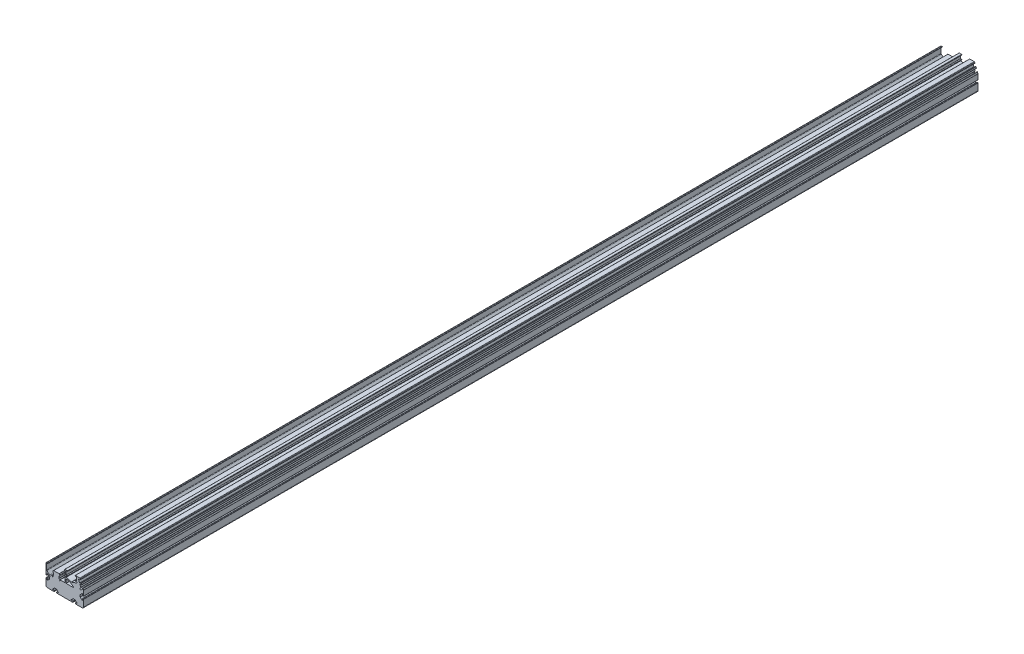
SolidWorks part; units mm, degrees
ref_plane "前视基准面" through (0, 0, 0) normal (0, 0, 1) x (1, 0, 0)
ref_plane "上视基准面" through (0, 0, 0) normal (0, 1, 0) x (1, 0, 0)
ref_plane "右视基准面" through (0, 0, 0) normal (1, 0, 0) x (0, 0, -1)
sketch "草图1" plane through (0, 0, 0) normal (0, 0, 1) x (1, 0, 0)
  point P0 (0, 0)
  line B0 (-40, 43) -> (-40, 23)
  line B1 (-37, 0) -> (-22.9, 0)
  line B2 (-16.9, 0) -> (16.9, 0)
  line B3 (-40, 17) -> (-40, 3)
  line B4 (-37, 30.2255) -> (-37, 35.1341)
  line B5 (-23.6097, 24) -> (-31.6872, 14.3736)
  arc B6 (-8.137, 5.7086) -> (-5.2735, 6.1676) centre (-6.7052, 5.9381) cw
  arc B7 (-2.8676, 8.5735) -> (-5.2735, 6.1676) centre (-3.2, 6.5) cw
  line B8 (1.5, 2.8) -> (1.5, 24)
  line B9 (-1.5, 11.8675) -> (-1.5, 24)
  arc B10 (-18.9401, 28.8601) -> (18.9401, 28.8601) centre (0, 9.1989) cw
  line B11 (-0.5, 46) -> (-9, 46)
  arc B12 (-32.013, 6.2667) -> (-29.0223, 6.1) centre (-30.5223, 6.1) cw
  line B13 (-17.7929, 7.3) -> (-13.8464, 3.3536)
  line B14 (-16.6938, 9.4536) -> (-9.6866, 2.4464)
  line B15 (-25.9536, 3.3536) -> (-22.0071, 7.3)
  line B16 (-28.1687, 4.3911) -> (-23.1062, 9.4536)
  arc B17 (-25.6, 2.5) -> (-25.9536, 3.3536) centre (-25.6, 3) cw
  arc B18 (-37, 0) -> (-40, 3) centre (-37, 3) cw
  arc B19 (34.1756, 8.5986) -> (33.2541, 9.3097) centre (34.2116, 9.598) cw
  arc B20 (34.1756, 8.5986) -> (32.013, 6.2667) centre (34.1, 6.5) cw
  line B21 (40, 3) -> (40, 17)
  line B22 (22.9, 0) -> (37, 0)
  line B23 (39.9642, 34.0894) -> (38.923, 36.6926)
  line B24 (-26.5, 39.3517) -> (-26.5, 25.7157)
  line B25 (-31.7829, 14.1964) -> (-33.2541, 9.3097)
  arc B26 (-40, 43) -> (-37, 46) centre (-37, 43) cw
  line B27 (-37.5, 23) -> (-37.5, 25.7)
  arc B28 (-32.013, 6.2667) -> (-34.1756, 8.5986) centre (-34.1, 6.5) cw
  line B29 (28.1687, 4.3911) -> (23.1062, 9.4536)
  line B30 (24.9, 51.3) -> (24.9, 45.8)
  line B31 (26.5, 40.2) -> (14.2747, 35.9905)
  line B32 (24.1757, 36.5441) -> (18.0045, 34.4192)
  line B33 (23.6097, 24) -> (31.6872, 14.3736)
  line B34 (31.7829, 14.1964) -> (33.2541, 9.3097)
  arc B35 (29.0223, 6.1) -> (32.013, 6.2667) centre (30.5223, 6.1) cw
  line B36 (13.8464, 3.3536) -> (17.7929, 7.3)
  line B37 (-1.5, 24) -> (-23.6097, 24)
  arc B38 (-34.8646, 37.3029) -> (-34.9665, 35.3055) centre (-34.9156, 36.3042) cw
  line B39 (-26.617, 25.3943) -> (-28.7993, 22.7935)
  line B40 (9.3331, 2.3) -> (2, 2.3)
  line B41 (1.5, 24) -> (23.6097, 24)
  line B42 (17.7929, 7.3) -> (22.0071, 7.3)
  line B43 (22.7527, 9.6) -> (17.0473, 9.6)
  line B44 (2.9, 45.8) -> (2.9, 51.3)
  line B45 (18.5932, 28) -> (-18.5932, 28)
  line B46 (23.1345, 28.6111) -> (28.8251, 21.8294)
  arc B47 (17.8714, 33.5434) -> (23.1345, 28.6111) centre (0, 9.1989) cw
  line B48 (-29.5359, 22.7614) -> (-37, 30.2255)
  arc B49 (-34.8646, 37.3029) -> (-32.5029, 39.6646) centre (-34.75, 39.55) cw
  line B50 (-32.7, 17.8929) -> (-36.6464, 13.9464)
  line B51 (32.7, 17.8929) -> (32.7, 22.1071)
  line B52 (-22.7527, 9.6) -> (-17.0473, 9.6)
  arc B53 (-2.8676, 8.5735) -> (-2.4086, 11.437) centre (-2.6381, 10.0052) cw
  line B54 (-36.6464, 26.0536) -> (-32.7, 22.1071)
  arc B55 (-13.0456, 37.6811) -> (-22.9544, 37.6811) centre (-18, 49.7) cw
  line B56 (-9.5, 43.8) -> (-14.9, 43.8)
  line B57 (0, 51.5) -> (0, 46.5)
  arc B58 (1.7707, 39.347) -> (13.8821, 36.0192) centre (0, 9.1989) cw
  arc B59 (22, 52) -> (22.5, 52.5) centre (22.5, 52) cw
  line B60 (29.0625, 48.9578) -> (32.3122, 50.2576)
  line B61 (31.5137, 42.8298) -> (29.0625, 48.9578)
  arc B62 (26.7003, 36.7154) -> (29.2134, 34.5155) centre (28.95, 36.75) cw
  line B63 (-15.2662, 41.6561) -> (-12.7646, 38.9655)
  line B64 (2.9, 51.3) -> (5.3, 51.3)
  line B65 (-27, 46) -> (-37, 46)
  line B66 (-23.2354, 38.9655) -> (-20.7338, 41.6561)
  arc B67 (-30.5055, 39.7665) -> (-32.5029, 39.6646) centre (-31.5042, 39.7156) cw
  line B68 (-26.5, 43.8) -> (-26.5, 45.5)
  line B69 (26.5, 44.5) -> (26.5, 40.2)
  line B70 (1.3, 44.5) -> (5.3, 44.5)
  line B71 (-30.0723, 41.7029) -> (-26.75, 39.7847)
  line B72 (-14.2, 2.5) -> (-16.9, 2.5)
  line B73 (37.5, 17) -> (37.5, 14.3)
  line B74 (29.5617, 21.7972) -> (36.8536, 29.0891)
  arc B75 (34.9969, 32.0491) -> (32.5928, 34.4532) centre (33.7949, 33.2512) cw
  arc B76 (29.4475, 32.5292) -> (29.2134, 34.5155) centre (29.3304, 33.5223) cw
  arc B77 (26.7003, 36.7154) -> (24.7924, 36.2809) centre (25.7004, 36.7) cw
  arc B78 (36.178, 30.4208) -> (30.2441, 32.2109) centre (33.7949, 33.2512) cw
  line B79 (-21.1, 43.8) -> (-26.5, 43.8)
  line B80 (-15.4, 43.3) -> (-15.4, 41.9965)
  line B81 (-20.6, 42.0016) -> (-20.6, 43.3)
  arc B82 (-22.9544, 37.6811) -> (-23.2354, 38.9655) centre (-22.6495, 38.4207) cw
  arc B83 (-30.7884, 41.0888) -> (-30.5055, 39.7665) centre (-34.75, 39.55) cw
  arc B84 (-20.6, 41.9965) -> (-20.7338, 41.6561) centre (-21.1, 41.9965) cw
  arc B85 (-27, 46) -> (-26.5, 45.5) centre (-27, 45.5) cw
  arc B86 (-21.1, 43.8) -> (-20.6, 43.3) centre (-21.1, 43.3) cw
  arc B87 (-26.75, 39.7847) -> (-26.5, 39.3517) centre (-27, 39.3517) cw
  arc B88 (-30.7884, 41.0888) -> (-30.0723, 41.7029) centre (-30.3223, 41.2698) cw
  arc B89 (-12.7646, 38.9655) -> (-13.0456, 37.6811) centre (-13.3505, 38.4207) cw
  arc B90 (-15.2662, 41.6561) -> (-15.4, 41.9965) centre (-14.9, 41.9965) cw
  line B91 (-9.5, 45.5) -> (-9.5, 43.8)
  arc B92 (-15.4, 43.3) -> (-14.9, 43.8) centre (-14.9, 43.3) cw
  arc B93 (-9.5, 45.5) -> (-9, 46) centre (-9, 45.5) cw
  line B94 (32.1822, 41.1586) -> (35.4319, 42.4584)
  line B95 (32.7, 22.1071) -> (36.6464, 26.0536)
  arc B96 (40, 3) -> (37, 0) centre (37, 3) cw
  line B97 (22.0071, 7.3) -> (25.9536, 3.3536)
  arc B98 (29.6786, 32.5629) -> (30.2441, 32.2109) centre (29.7643, 32.0703) cw
  arc B99 (5.8, 51.8) -> (5.3, 51.3) centre (5.3, 51.8) cw
  line B100 (32.5928, 34.4532) -> (33.9822, 35.8427)
  line B101 (-17.4, 2) -> (-17.4, 0.5)
  line B102 (22.5, 44.5) -> (26.5, 44.5)
  arc B103 (17.8714, 33.5434) -> (18.0045, 34.4192) centre (18.1673, 33.9464) cw
  arc B104 (31.9232, 52.5) -> (32.8514, 51.8719) centre (31.9232, 51.5) cw
  line B105 (31.9232, 52.5) -> (22.5, 52.5)
  arc B106 (5.3, 52.5) -> (5.8, 52) centre (5.3, 52) cw
  line B107 (5.3, 52.5) -> (1, 52.5)
  line B108 (5.8, 51.8) -> (5.8, 52)
  line B109 (1.3, 39.8461) -> (1.3, 44.5)
  arc B110 (0, 51.5) -> (1, 52.5) centre (1, 51.5) cw
  line B111 (5.3, 45.8) -> (2.9, 45.8)
  arc B112 (5.3, 45.8) -> (5.8, 45.3) centre (5.3, 45.3) cw
  arc B113 (5.8, 45) -> (5.3, 44.5) centre (5.3, 45) cw
  arc B114 (1.7707, 39.347) -> (1.3, 39.8461) centre (1.8, 39.8461) cw
  arc B115 (14.2747, 35.9905) -> (13.8821, 36.0192) centre (14.1119, 36.4633) cw
  arc B116 (22.5, 44.5) -> (22, 45) centre (22.5, 45) cw
  arc B117 (22, 45.3) -> (22.5, 45.8) centre (22.5, 45.3) cw
  line B118 (24.9, 45.8) -> (22.5, 45.8)
  arc B119 (22.5, 51.3) -> (22, 51.8) centre (22.5, 51.8) cw
  line B120 (22, 45.3) -> (22, 45)
  line B121 (5.8, 45) -> (5.8, 45.3)
  line B122 (22, 52) -> (22, 51.8)
  arc B123 (33.3901, 50.5272) -> (33.1115, 49.8773) centre (32.9259, 50.3415) cw
  line B124 (33.3901, 50.5272) -> (32.8514, 51.8719)
  arc B125 (33.0187, 49.8402) -> (32.3688, 50.1187) centre (32.833, 50.3044) cw
  arc B126 (35.0791, 44.956) -> (35.729, 44.6775) centre (35.2648, 44.4918) cw
  arc B127 (34.7077, 44.269) -> (34.9862, 44.9189) centre (35.1719, 44.4546) cw
  arc B128 (36.1375, 42.0406) -> (35.4876, 42.3192) centre (35.9518, 42.5048) cw
  arc B129 (36.5089, 42.7277) -> (36.2304, 42.0777) centre (36.0447, 42.542) cw
  line B130 (34.0929, 36.3819) -> (32.1822, 41.1586)
  arc B131 (34.0929, 36.3819) -> (33.9822, 35.8427) centre (33.6286, 36.1962) cw
  line B132 (37.9016, 36.2841) -> (38.2817, 35.3339)
  arc B133 (37.9016, 36.2841) -> (38.1802, 36.934) centre (38.3659, 36.4697) cw
  line B134 (38.273, 36.9711) -> (38.1802, 36.934)
  arc B135 (38.273, 36.9711) -> (38.923, 36.6926) centre (38.4587, 36.5069) cw
  line B136 (40, 23) -> (40, 33.9037)
  line B137 (38.2817, 35.3339) -> (34.9969, 32.0491)
  arc B138 (39.9642, 34.0894) -> (40, 33.9037) centre (39.5, 33.9037) cw
  line B139 (35.4319, 42.4584) -> (35.4876, 42.3192)
  line B140 (36.1375, 42.0406) -> (36.2304, 42.0777)
  line B141 (36.5089, 42.7277) -> (35.729, 44.6775)
  line B142 (35.0791, 44.956) -> (34.9862, 44.9189)
  line B143 (34.7077, 44.269) -> (34.7634, 44.1297)
  line B144 (32.3122, 50.2576) -> (32.3688, 50.1187)
  line B145 (33.0187, 49.8402) -> (33.1115, 49.8773)
  arc B146 (24.1757, 36.5441) -> (24.7924, 36.2809) centre (24.3385, 36.0713) cw
  line B147 (34.7634, 44.1297) -> (31.5137, 42.8298)
  line B148 (22.5, 51.3) -> (24.9, 51.3)
  line B149 (16.6938, 9.4536) -> (9.6866, 2.4464)
  line B150 (36.6464, 13.9464) -> (32.7, 17.8929)
  line B151 (39.5, 17.5) -> (38, 17.5)
  line B152 (-32.7, 22.1071) -> (-32.7, 17.8929)
  line B153 (-39.5, 22.5) -> (-38, 22.5)
  arc B154 (-39.5, 22.5) -> (-40, 23) centre (-39.5, 23) cw
  arc B155 (-37.5, 23) -> (-38, 22.5) centre (-38, 23) cw
  arc B156 (-37.5, 25.7) -> (-36.6464, 26.0536) centre (-37, 25.7) cw
  line B157 (-37.5, 14.3) -> (-37.5, 17)
  arc B158 (-36.6464, 13.9464) -> (-37.5, 14.3) centre (-37, 14.3) cw
  line B159 (-38, 17.5) -> (-39.5, 17.5)
  arc B160 (-38, 17.5) -> (-37.5, 17) centre (-38, 17) cw
  arc B161 (-40, 17) -> (-39.5, 17.5) centre (-39.5, 17) cw
  arc B162 (18.9401, 28.8601) -> (18.5932, 28) centre (18.5932, 28.5) cw
  arc B163 (40, 23) -> (39.5, 22.5) centre (39.5, 23) cw
  line B164 (37.5, 25.7) -> (37.5, 23)
  arc B165 (38, 22.5) -> (37.5, 23) centre (38, 23) cw
  arc B166 (36.6464, 26.0536) -> (37.5, 25.7) centre (37, 25.7) cw
  arc B167 (37.5, 14.3) -> (36.6464, 13.9464) centre (37, 14.3) cw
  arc B168 (37.5, 17) -> (38, 17.5) centre (38, 17) cw
  arc B169 (39.5, 17.5) -> (40, 17) centre (39.5, 17) cw
  arc B170 (29.5617, 21.7972) -> (28.8251, 21.8294) centre (29.2081, 22.1508) cw
  arc B171 (-22.4, 0.5) -> (-22.9, 0) centre (-22.9, 0.5) cw
  arc B172 (-22.9, 2.5) -> (-22.4, 2) centre (-22.9, 2) cw
  line B173 (-22.0071, 7.3) -> (-17.7929, 7.3)
  arc B174 (-13.8464, 3.3536) -> (-14.2, 2.5) centre (-14.2, 3) cw
  arc B175 (-17.4, 2) -> (-16.9, 2.5) centre (-16.9, 2) cw
  arc B176 (-16.9, 0) -> (-17.4, 0.5) centre (-16.9, 0.5) cw
  line B177 (-22.4, 0.5) -> (-22.4, 2)
  arc B178 (-28.1687, 4.3911) -> (-29.0223, 4.7446) centre (-28.5223, 4.7446) cw
  arc B179 (-33.2541, 9.3097) -> (-34.1756, 8.5986) centre (-34.2116, 9.598) cw
  arc B180 (-31.7829, 14.1964) -> (-31.6872, 14.3736) centre (-31.3041, 14.0522) cw
  arc B181 (-1.5, 11.8675) -> (-2.1091, 11.3795) centre (-2, 11.8675) cw
  arc B182 (-2.4086, 11.437) -> (-2.1091, 11.3795) centre (-3.2, 6.5) cw
  arc B183 (-6.8995, 3.1364) -> (-7.2694, 2.3) centre (-7.2694, 2.8) cw
  arc B184 (-6.8995, 3.1364) -> (-8.137, 5.7086) centre (-3.2, 6.5) cw
  line B185 (-9.3331, 2.3) -> (-7.2694, 2.3)
  arc B186 (-9.3331, 2.3) -> (-9.6866, 2.4464) centre (-9.3331, 2.8) cw
  arc B187 (-23.1062, 9.4536) -> (-22.7527, 9.6) centre (-22.7527, 9.1) cw
  arc B188 (-17.0473, 9.6) -> (-16.6938, 9.4536) centre (-17.0473, 9.1) cw
  line B189 (-22.9, 2.5) -> (-25.6, 2.5)
  line B190 (-29.0223, 6.1) -> (-29.0223, 4.7446)
  arc B191 (-18.5932, 28) -> (-18.9401, 28.8601) centre (-18.5932, 28.5) cw
  line B192 (22.4, 2) -> (22.4, 0.5)
  arc B193 (17.4, 0.5) -> (16.9, 0) centre (16.9, 0.5) cw
  arc B194 (22.9, 0) -> (22.4, 0.5) centre (22.9, 0.5) cw
  arc B195 (22.4, 2) -> (22.9, 2.5) centre (22.9, 2) cw
  arc B196 (25.9536, 3.3536) -> (25.6, 2.5) centre (25.6, 3) cw
  line B197 (16.9, 2.5) -> (14.2, 2.5)
  arc B198 (16.9, 2.5) -> (17.4, 2) centre (16.9, 2) cw
  line B199 (17.4, 0.5) -> (17.4, 2)
  arc B200 (14.2, 2.5) -> (13.8464, 3.3536) centre (14.2, 3) cw
  arc B201 (2, 2.3) -> (1.5, 2.8) centre (2, 2.8) cw
  arc B202 (31.6872, 14.3736) -> (31.7829, 14.1964) centre (31.3041, 14.0522) cw
  arc B203 (29.0223, 4.7446) -> (28.1687, 4.3911) centre (28.5223, 4.7446) cw
  line B204 (29.0223, 6.1) -> (29.0223, 4.7446)
  arc B205 (22.7527, 9.6) -> (23.1062, 9.4536) centre (22.7527, 9.1) cw
  arc B206 (16.6938, 9.4536) -> (17.0473, 9.6) centre (17.0473, 9.1) cw
  arc B207 (9.6866, 2.4464) -> (9.3331, 2.3) centre (9.3331, 2.8) cw
  arc B208 (-28.7993, 22.7935) -> (-29.5359, 22.7614) centre (-29.1823, 23.1149) cw
  arc B209 (-26.5, 25.7157) -> (-26.617, 25.3943) centre (-27, 25.7157) cw
  arc B210 (-37, 35.1341) -> (-36.3158, 35.5989) centre (-36.5, 35.1341) cw
  arc B211 (-34.9665, 35.3055) -> (-36.3158, 35.5989) centre (-34.75, 39.55) cw
  arc B212 (29.6786, 32.5629) -> (29.4475, 32.5292) centre (28.95, 36.75) cw
  arc B213 (36.178, 30.4208) -> (37, 30.0383) centre (36.5, 30.0383) cw
  arc B214 (37, 29.4426) -> (36.8536, 29.0891) centre (36.5, 29.4426) cw
  line B215 (37, 29.4426) -> (37, 30.0383)
sketch_block_instance "XYZ-DG182-3"
sketch_block "XYZ-DG182"
sketch "草图2" plane through (0, 0, 0) normal (0, 0, 1) x (1, 0, 0)
  line L0 (-37, 0) -> (37, 0)
  line L3 (40, 3) -> (40, 52.5)
  line L4 (40, 52.5) -> (1, 52.5)
  line L5 (-40, 43) -> (-40, 3)
  line L7 (-37, 46) -> (-27, 46)
  line L8 (0, 46.5) -> (0, 51.5)
  line L9 (-20.7338, 41.6561) -> (-23.2354, 38.9655)
  line L10 (-26.5, 45.5) -> (-26.5, 43.8)
  line L11 (-26.5, 43.8) -> (-21.1, 43.8)
  line L12 (-20.6, 43.3) -> (-20.6, 41.9965)
  line L13 (-12.7646, 38.9655) -> (-15.2662, 41.6561)
  line L14 (-15.4, 41.9965) -> (-15.4, 43.3)
  line L15 (-14.9, 43.8) -> (-9.5, 43.8)
  line L16 (-9.5, 43.8) -> (-9.5, 45.5)
  line L17 (-9, 46) -> (-0.5, 46)
  arc A0 (-20.7338, 41.6561) -> (-20.6, 41.9965) centre (-21.1, 41.9965) ccw
  arc A1 (-23.2354, 38.9655) -> (-22.9544, 37.6811) centre (-22.6495, 38.4207) ccw
  arc A2 (-22.9544, 37.6811) -> (-13.0456, 37.6811) centre (-18, 49.7) ccw
  arc A3 (-12.7646, 38.9655) -> (-13.0456, 37.6811) centre (-13.3505, 38.4207) cw
  arc A4 (-15.2662, 41.6561) -> (-15.4, 41.9965) centre (-14.9, 41.9965) cw
  arc A5 (-14.9, 43.8) -> (-15.4, 43.3) centre (-14.9, 43.3) ccw
  arc A6 (-9.5, 45.5) -> (-9, 46) centre (-9, 45.5) cw
  arc A7 (-21.1, 43.8) -> (-20.6, 43.3) centre (-21.1, 43.3) cw
  arc A8 (-37, 46) -> (-40, 43) centre (-37, 43) ccw
  arc A9 (-40, 3) -> (-37, 0) centre (-37, 3) ccw
  arc A10 (37, 0) -> (40, 3) centre (37, 3) ccw
  arc A11 (-27, 46) -> (-26.5, 45.5) centre (-27, 45.5) cw
  arc A12 (1, 52.5) -> (0, 51.5) centre (1, 51.5) ccw
  arc A13 (0, 46.5) -> (-0.5, 46) centre (-0.5, 46.5) cw
  dimension "D2" = 3
  dimension "D8" = 0.5
  dimension "D9" = 1
  dimension "D7" = 0.5
  dimension "D5" = 3
  dimension "D6" = 3
  dimension "D4" = 0.5
  dimension "D10" = 0.5
  dimension "D1" = 52.5
  dimension "D3" = 40
extrude "凸台-拉伸1" add sketch "草图2" along normal blind 1905
sketch "草图3" plane through (0, 0, 1905) normal (0, 0, 1) x (1, 0, 0)
  line L0 (5.8, 52) -> (5.8, 51.8)
  line L1 (5.3, 51.3) -> (2.9, 51.3)
  line L2 (2.9, 51.3) -> (2.9, 45.8)
  line L3 (2.9, 45.8) -> (5.3, 45.8)
  line L4 (5.3, 44.5) -> (1.3, 44.5)
  line L5 (1.3, 44.5) -> (1.3, 39.8461)
  line L6 (14.2747, 35.9905) -> (26.5, 40.2)
  line L7 (26.5, 40.2) -> (26.5, 44.5)
  line L8 (26.5, 44.5) -> (22.5, 44.5)
  line L9 (22, 45) -> (22, 45.3)
  line L10 (5.8, 45) -> (5.8, 45.3)
  line L11 (22, 52) -> (22, 51.8)
  line L12 (22.5, 51.3) -> (24.9, 51.3)
  line L13 (24.9, 51.3) -> (24.9, 45.8)
  line L14 (24.9, 45.8) -> (22.5, 45.8)
  arc A0 (5.3, 52.5) -> (5.8, 52) centre (5.3, 52) cw
  arc A1 (5.3, 51.3) -> (5.8, 51.8) centre (5.3, 51.8) ccw
  arc A2 (5.3, 45.8) -> (5.8, 45.3) centre (5.3, 45.3) cw
  arc A3 (5.8, 45) -> (5.3, 44.5) centre (5.3, 45) cw
  arc A4 (1.3, 39.8461) -> (1.7707, 39.347) centre (1.8, 39.8461) ccw
  arc A5 (13.8821, 36.0192) -> (14.2747, 35.9905) centre (14.1119, 36.4633) ccw
  arc A6 (1.7707, 39.347) -> (13.8821, 36.0192) centre (0, 9.1989) cw
  arc A7 (22.5, 44.5) -> (22, 45) centre (22.5, 45) cw
  arc A8 (22.5, 45.8) -> (22, 45.3) centre (22.5, 45.3) ccw
  arc A9 (22.5, 52.5) -> (22, 52) centre (22.5, 52) ccw
  arc A10 (22, 51.8) -> (22.5, 51.3) centre (22.5, 51.8) ccw
  dimension "D1" = 0.5
  dimension "D2" = 0.5
  dimension "D3" = 0.5
  dimension "D4" = 30.2
  dimension "D5" = 0.5
  dimension "D6" = 0.5
extrude "切除-拉伸2" cut sketch "草图3" against normal through all and the other way through all flip side to cut
sketch "草图4" plane through (0, 0, 1905) normal (0, 0, 1) x (1, 0, 0)
  line L0 (39.9642, 34.0894) -> (38.923, 36.6926)
  line L1 (38.273, 36.9711) -> (38.1802, 36.934)
  line L2 (37.9016, 36.2841) -> (38.2817, 35.3339)
  line L3 (38.2817, 35.3339) -> (34.9969, 32.0491)
  line L4 (32.5928, 34.4532) -> (33.9822, 35.8427)
  line L6 (34.0929, 36.3819) -> (32.1822, 41.1586)
  line L8 (35.4876, 42.3192) -> (35.4319, 42.4584)
  line L9 (35.4319, 42.4584) -> (32.1822, 41.1586)
  line L10 (36.1375, 42.0406) -> (36.2304, 42.0777)
  line L11 (36.5089, 42.7277) -> (35.729, 44.6775)
  line L12 (35.0791, 44.956) -> (34.9862, 44.9189)
  line L13 (34.7077, 44.269) -> (34.7634, 44.1297)
  line L14 (34.7634, 44.1297) -> (31.5137, 42.8298)
  line L15 (31.5137, 42.8298) -> (29.0625, 48.9578)
  line L16 (29.0625, 48.9578) -> (32.3122, 50.2576)
  line L17 (32.3122, 50.2576) -> (32.3688, 50.1187)
  line L18 (33.0187, 49.8402) -> (33.1115, 49.8773)
  line L19 (32.8514, 51.8719) -> (33.3901, 50.5272)
  arc A0 (31.9232, 52.5) -> (32.8514, 51.8719) centre (31.9232, 51.5) cw
  arc A1 (33.3901, 50.5272) -> (33.1115, 49.8773) centre (32.9259, 50.3415) cw
  arc A2 (33.0187, 49.8402) -> (32.3688, 50.1187) centre (32.833, 50.3044) cw
  arc A3 (34.7077, 44.269) -> (34.9862, 44.9189) centre (35.1719, 44.4546) cw
  arc A4 (35.0791, 44.956) -> (35.729, 44.6775) centre (35.2648, 44.4918) cw
  arc A5 (36.5089, 42.7277) -> (36.2304, 42.0777) centre (36.0447, 42.542) cw
  arc A6 (36.1375, 42.0406) -> (35.4876, 42.3192) centre (35.9518, 42.5048) cw
  arc A7 (34.0929, 36.3819) -> (33.9822, 35.8427) centre (33.6286, 36.1962) cw
  arc A8 (32.5928, 34.4532) -> (34.9969, 32.0491) centre (33.7949, 33.2512) ccw
  arc A9 (37.9016, 36.2841) -> (38.1802, 36.934) centre (38.3659, 36.4697) cw
  arc A10 (38.273, 36.9711) -> (38.923, 36.6926) centre (38.4587, 36.5069) cw
  arc A11 (39.9642, 34.0894) -> (40, 33.9037) centre (39.5, 33.9037) cw
  dimension "D1" = 1
  dimension "D2" = 0.5
  dimension "D3" = 0.5
  dimension "D4" = 1.7
  dimension "D5" = 0.5
  dimension "D6" = 0.5
  dimension "D7" = 0.5
extrude "切除-拉伸7" cut sketch "草图4" against normal through all
sketch "草图5" plane through (0, 0, 1905) normal (0, 0, 1) x (1, 0, 0)
  line L0 (-38, 17.5) -> (-39.5, 17.5)
  line L1 (-37.5, 14.3) -> (-37.5, 17)
  line L2 (-36.6464, 13.9464) -> (-32.7, 17.8929)
  line L3 (-32.7, 17.8929) -> (-32.7, 22.1071)
  line L4 (-32.7, 22.1071) -> (-36.6464, 26.0536)
  line L5 (-37.5, 25.7) -> (-37.5, 23)
  line L6 (-39.5, 22.5) -> (-38, 22.5)
  arc A0 (-40, 23) -> (-39.5, 22.5) centre (-39.5, 23) ccw
  arc A1 (-38, 22.5) -> (-37.5, 23) centre (-38, 23) ccw
  arc A2 (-37.5, 25.7) -> (-36.6464, 26.0536) centre (-37, 25.7) cw
  arc A3 (-36.6464, 13.9464) -> (-37.5, 14.3) centre (-37, 14.3) cw
  arc A4 (-38, 17.5) -> (-37.5, 17) centre (-38, 17) cw
  arc A5 (-40, 17) -> (-39.5, 17.5) centre (-39.5, 17) cw
  dimension "D1" = 0.5
  dimension "D2" = 0.5
  dimension "D3" = 0.5
  dimension "D4" = 0.5
  dimension "D5" = 0.5
extrude "切除-拉伸8" cut sketch "草图5" against normal through all
sketch "草图6" plane through (0, 0, 1905) normal (0, 0, 1) x (1, 0, 0)
  line L0 (38, 17.5) -> (39.5, 17.5)
  line L1 (37.5, 17) -> (37.5, 14.3)
  line L2 (36.6464, 13.9464) -> (32.7, 17.8929)
  line L3 (32.7, 17.8929) -> (32.7, 22.1071)
  line L4 (32.7, 22.1071) -> (36.6464, 26.0536)
  line L5 (37.5, 25.7) -> (37.5, 23)
  line L6 (38, 22.5) -> (39.5, 22.5)
  arc A0 (39.5, 22.5) -> (40, 23) centre (39.5, 23) ccw
  arc A1 (38, 22.5) -> (37.5, 23) centre (38, 23) cw
  arc A2 (37.5, 25.7) -> (36.6464, 26.0536) centre (37, 25.7) ccw
  arc A3 (36.6464, 13.9464) -> (37.5, 14.3) centre (37, 14.3) ccw
  arc A4 (37.5, 17) -> (38, 17.5) centre (38, 17) cw
  arc A5 (39.5, 17.5) -> (40, 17) centre (39.5, 17) cw
  dimension "D3" = 0.5
  dimension "D4" = 0.5
extrude "切除-拉伸9" cut sketch "草图6" against normal through all
sketch "草图8" plane through (0, 0, 1905) normal (0, 0, 1) x (1, 0, 0)
  line L0 (17.4, 0.5) -> (17.4, 2)
  line L1 (16.9, 2.5) -> (14.2, 2.5)
  line L2 (13.8464, 3.3536) -> (17.7929, 7.3)
  line L3 (17.7929, 7.3) -> (22.0071, 7.3)
  line L4 (22.0071, 7.3) -> (25.9536, 3.3536)
  line L5 (25.6, 2.5) -> (22.9, 2.5)
  line L6 (22.4, 2) -> (22.4, 0.5)
  arc A0 (16.9, 0) -> (17.4, 0.5) centre (16.9, 0.5) ccw
  arc A1 (22.4, 0.5) -> (22.9, 0) centre (22.9, 0.5) ccw
  arc A2 (22.4, 2) -> (22.9, 2.5) centre (22.9, 2) cw
  arc A3 (25.6, 2.5) -> (25.9536, 3.3536) centre (25.6, 3) ccw
  arc A4 (17.4, 2) -> (16.9, 2.5) centre (16.9, 2) ccw
  arc A5 (14.2, 2.5) -> (13.8464, 3.3536) centre (14.2, 3) cw
  dimension "D1" = 0.5
  dimension "D2" = 0.5
  dimension "D3" = 0.5
  dimension "D4" = 0.5
extrude "切除-拉伸14" cut sketch "草图8" against normal through all flip side to cut
sketch "草图9" plane through (0, 0, 1905) normal (0, 0, 1) x (1, 0, 0)
  line L0 (22.7527, 9.6) -> (17.0473, 9.6)
  line L1 (16.6938, 9.4536) -> (9.6866, 2.4464)
  line L2 (2, 2.3) -> (9.3331, 2.3)
  line L3 (1.5, 2.8) -> (1.5, 24)
  line L4 (1.5, 24) -> (23.6097, 24)
  line L5 (23.6097, 24) -> (31.6872, 14.3736)
  line L6 (31.7829, 14.1964) -> (33.2541, 9.3097)
  line L7 (29.0223, 6.1) -> (29.0223, 4.7446)
  line L8 (23.1062, 9.4536) -> (28.1687, 4.3911)
  arc A0 (2, 2.3) -> (1.5, 2.8) centre (2, 2.8) cw
  arc A1 (31.6872, 14.3736) -> (31.7829, 14.1964) centre (31.3041, 14.0522) cw
  arc A2 (33.2541, 9.3097) -> (34.1756, 8.5986) centre (34.2116, 9.598) ccw
  arc A3 (28.1687, 4.3911) -> (29.0223, 4.7446) centre (28.5223, 4.7446) ccw
  arc A4 (29.0223, 6.1) -> (32.013, 6.2667) centre (30.5223, 6.1) cw
  arc A5 (34.1756, 8.5986) -> (32.013, 6.2667) centre (34.1, 6.5) cw
  arc A6 (22.7527, 9.6) -> (23.1062, 9.4536) centre (22.7527, 9.1) cw
  arc A7 (16.6938, 9.4536) -> (17.0473, 9.6) centre (17.0473, 9.1) cw
  arc A8 (9.3331, 2.3) -> (9.6866, 2.4464) centre (9.3331, 2.8) ccw
  dimension "D1" = 0.5
  dimension "D2" = 0.5
extrude "切除-拉伸15" [suppressed] cut sketch "草图9" against normal through all
sketch "草图11" plane through (0, 0, 1905) normal (0, 0, 1) x (1, 0, 0)
  line L0 (-28.7993, 22.7935) -> (-26.617, 25.3943)
  line L1 (-26.5, 25.7157) -> (-26.5, 39.3517)
  line L2 (-26.75, 39.7847) -> (-30.0723, 41.7029)
  line L3 (-37, 35.1341) -> (-37, 30.2255)
  line L4 (-37, 30.2255) -> (-29.5359, 22.7614)
  arc A0 (-29.5359, 22.7614) -> (-28.7993, 22.7935) centre (-29.1823, 23.1149) ccw
  arc A1 (-26.617, 25.3943) -> (-26.5, 25.7157) centre (-27, 25.7157) ccw
  arc A2 (-37, 35.1341) -> (-36.3158, 35.5989) centre (-36.5, 35.1341) cw
  arc A3 (-36.3158, 35.5989) -> (-34.9665, 35.3055) centre (-34.75, 39.55) ccw
  arc A4 (-34.9665, 35.3055) -> (-34.8646, 37.3029) centre (-34.9156, 36.3042) ccw
  arc A5 (-32.5029, 39.6646) -> (-34.8646, 37.3029) centre (-34.75, 39.55) ccw
  arc A6 (-30.5055, 39.7665) -> (-32.5029, 39.6646) centre (-31.5042, 39.7156) cw
  arc A7 (-30.7884, 41.0888) -> (-30.5055, 39.7665) centre (-34.75, 39.55) cw
  arc A8 (-30.0723, 41.7029) -> (-30.7884, 41.0888) centre (-30.3223, 41.2698) ccw
  arc A9 (-26.75, 39.7847) -> (-26.5, 39.3517) centre (-27, 39.3517) cw
  dimension "D1" = 0.5
  dimension "D2" = 0.5
  dimension "D3" = 0.5
extrude "切除-拉伸16" cut sketch "草图11" against normal through all
sketch "草图12" plane through (0, 0, 1905) normal (0, 0, 1) x (1, 0, 0)
  line L0 (-18.5932, 28) -> (18.5932, 28)
  arc A0 (-18.9401, 28.8601) -> (-18.5932, 28) centre (-18.5932, 28.5) ccw
  arc A1 (18.5932, 28) -> (18.9401, 28.8601) centre (18.5932, 28.5) ccw
  arc A2 (-18.9401, 28.8601) -> (18.9401, 28.8601) centre (0, 9.1989) cw
extrude "切除-拉伸17" cut sketch "草图12" against normal through all
sketch "草图13" plane through (0, 0, 1905) normal (0, 0, 1) x (1, 0, 0)
  line L0 (23.1345, 28.6111) -> (28.8251, 21.8294)
  line L1 (29.5617, 21.7972) -> (36.8536, 29.0891)
  line L2 (37, 30.0383) -> (37, 29.4426)
  line L3 (29.4483, 32.5223) -> (29.6786, 32.5629)
  line L4 (24.1757, 36.5441) -> (18.0045, 34.4192)
  arc A0 (17.8714, 33.5434) -> (18.0045, 34.4192) centre (18.1673, 33.9464) cw
  arc A1 (24.1757, 36.5441) -> (24.7924, 36.2809) centre (24.3385, 36.0713) cw
  arc A2 (26.7003, 36.7154) -> (24.7924, 36.2809) centre (25.7004, 36.7) cw
  arc A3 (29.2134, 34.5155) -> (26.7003, 36.7154) centre (28.95, 36.75) ccw
  arc A4 (29.2134, 34.5155) -> (29.4483, 32.5223) centre (29.3308, 33.5189) ccw
  arc A5 (29.6786, 32.5629) -> (30.2441, 32.2109) centre (29.7643, 32.0703) cw
  arc A6 (36.178, 30.4208) -> (30.2441, 32.2109) centre (33.7949, 33.2512) cw
  arc A7 (37, 30.0383) -> (36.178, 30.4208) centre (36.5, 30.0383) ccw
  arc A8 (36.8536, 29.0891) -> (37, 29.4426) centre (36.5, 29.4426) ccw
  arc A9 (29.5617, 21.7972) -> (28.8251, 21.8294) centre (29.2081, 22.1508) cw
  arc A10 (23.1345, 28.6111) -> (17.8714, 33.5434) centre (0, 9.1989) ccw
  dimension "D1" = 1.0035
  dimension "D2" = 0.5
  dimension "D4" = 0.5
  dimension "D3" = 0.2338
extrude "切除-拉伸18" [suppressed] cut sketch "草图13" against normal through all
sketch "草图14" plane through (0, 0, 1905) normal (0, 0, 1) x (1, 0, 0)
  line L0 (-29.0223, 4.7446) -> (-29.0223, 6.1)
  line L1 (-28.1687, 4.3911) -> (-23.1062, 9.4536)
  line L2 (-33.2541, 9.3097) -> (-31.7829, 14.1964)
  line L3 (-31.6872, 14.3736) -> (-23.6097, 24)
  line L4 (-23.6097, 24) -> (-1.5, 24)
  line L5 (-1.5, 24) -> (-1.5, 11.8675)
  line L6 (-2.4086, 11.437) -> (-2.1091, 11.3795)
  line L7 (-9.3331, 2.3) -> (-7.2694, 2.3)
  line L8 (-9.6866, 2.4464) -> (-16.6938, 9.4536)
  line L9 (-17.0473, 9.6) -> (-22.7527, 9.6)
  arc A0 (-34.1756, 8.5986) -> (-32.013, 6.2667) centre (-34.1, 6.5) ccw
  arc A1 (-33.2541, 9.3097) -> (-34.1756, 8.5986) centre (-34.2116, 9.598) cw
  arc A2 (-31.7829, 14.1964) -> (-31.6872, 14.3736) centre (-31.3041, 14.0522) cw
  arc A3 (-1.5, 11.8675) -> (-2.1091, 11.3795) centre (-2, 11.8675) cw
  arc A4 (-2.4086, 11.437) -> (-2.8676, 8.5735) centre (-2.6381, 10.0052) ccw
  arc A5 (-5.2735, 6.1676) -> (-2.8676, 8.5735) centre (-3.2, 6.5) ccw
  arc A6 (-8.137, 5.7086) -> (-5.2735, 6.1676) centre (-6.7052, 5.9381) cw
  arc A7 (-6.8995, 3.1364) -> (-7.2694, 2.3) centre (-7.2694, 2.8) cw
  arc A8 (-8.137, 5.7086) -> (-6.8995, 3.1364) centre (-3.2, 6.5) ccw
  arc A9 (-9.3331, 2.3) -> (-9.6866, 2.4464) centre (-9.3331, 2.8) cw
  arc A10 (-17.0473, 9.6) -> (-16.6938, 9.4536) centre (-17.0473, 9.1) cw
  arc A11 (-22.7527, 9.6) -> (-23.1062, 9.4536) centre (-22.7527, 9.1) ccw
  arc A12 (-29.0223, 4.7446) -> (-28.1687, 4.3911) centre (-28.5223, 4.7446) ccw
  arc A13 (-29.0223, 6.1) -> (-32.013, 6.2667) centre (-30.5223, 6.1) ccw
  dimension "D1" = 1
  dimension "D2" = 0.5
  dimension "D3" = 1.45
  dimension "D4" = 0.5
  dimension "D5" = 0.5
  dimension "D6" = 0.5
extrude "切除-拉伸20" [suppressed] cut sketch "草图14" against normal through all
sketch "草图15" plane through (0, 0, 1905) normal (0, 0, 1) x (1, 0, 0)
  line L0 (-17.4, 2) -> (-17.4, 0.5)
  line L1 (-22.4, 0.5) -> (-22.4, 2)
  line L2 (-16.9, 2.5) -> (-14.2, 2.5)
  line L3 (-13.8464, 3.3536) -> (-17.7929, 7.3)
  line L4 (-17.7929, 7.3) -> (-22.0071, 7.3)
  line L5 (-22.0071, 7.3) -> (-25.9536, 3.3536)
  line L6 (-25.6, 2.5) -> (-22.9, 2.5)
  arc A0 (-22.9, 0) -> (-22.4, 0.5) centre (-22.9, 0.5) ccw
  arc A1 (-22.4, 2) -> (-22.9, 2.5) centre (-22.9, 2) ccw
  arc A2 (-25.6, 2.5) -> (-25.9536, 3.3536) centre (-25.6, 3) cw
  arc A3 (-13.8464, 3.3536) -> (-14.2, 2.5) centre (-14.2, 3) cw
  arc A4 (-16.9, 2.5) -> (-17.4, 2) centre (-16.9, 2) ccw
  arc A5 (-17.4, 0.5) -> (-16.9, 0) centre (-16.9, 0.5) ccw
  dimension "D1" = 0.5
  dimension "D2" = 0.5
extrude "切除-拉伸21" cut sketch "草图15" against normal through all and the other way through all flip side to cut
sketch "草图16" plane through (0, 0, 0) normal (0, 0, -1) x (-1, 0, 0)
  line L1 (0, 54.1382) -> (37, 54.1382)
  line L2 (0, 54.1382) -> (0, 30.2255)
  line L3 (0, 30.2255) -> (37, 30.2255)
  line L4 (37, 54.1382) -> (37, 30.2255)
  line L5 (0, 51.5) -> (0, 46.5) construction
extrude "切除-拉伸22" cut sketch "草图16" against normal through all
sketch "草图17" plane through (0, 0, 0) normal (0, 0, -1) x (-1, 0, 0)
  line L0 (18.5932, 28) -> (-18.5932, 28) construction
  line L1 (17.4119, 28) -> (26.5, 28)
  line L2 (17.4119, 28) -> (17.4119, 30.2255)
  line L3 (17.4119, 30.2255) -> (26.5, 30.2255)
  line L4 (26.5, 28) -> (26.5, 30.2255)
extrude "切除-拉伸23" cut sketch "草图17" against normal through all
sketch "草图18" plane through (0, 0, 0) normal (0, 0, -1) x (-1, 0, 0)
  line L0 (26.5, 28) -> (-18.5932, 28) construction
  line L1 (0, 51.5) -> (-2.9, 51.5)
  line L2 (0, 51.5) -> (0, 28)
  line L3 (0, 28) -> (-2.9, 28)
  line L4 (-2.9, 51.5) -> (-2.9, 28)
  line L5 (-2.9, 45.8) -> (-2.9, 51.3) construction
extrude "凸台-拉伸2" add sketch "草图18" against normal up to surface (1905 mm away)
sketch "草图21" plane through (0, 0, 0) normal (0, 0, -1) x (-1, 0, 0)
  line L0 (26.5, 28) -> (0, 28) construction
  line L1 (10, 28) -> (26, 28)
  line L2 (10, 28) -> (10, 25.8)
  line L3 (10, 25.8) -> (26, 25.8)
  line L4 (26, 28) -> (26, 25.8)
  line L5 (40, 43) -> (40, 23) construction
  dimension "D1" = 16
  dimension "D2" = 14
  dimension "D3" = 2.2
extrude "切除-拉伸24" cut sketch "草图21" against normal through all
sketch "草图22" plane through (0, 0, 0) normal (0, 0, -1) x (-1, 0, 0)
  line L0 (26.5, 28) -> (27.6941, 28)
  line L4 (37, 30.2255) -> (29.5359, 22.7614) construction
  line L5 (28.7993, 22.7935) -> (26.617, 25.3943) construction
  line L6 (26.5, 25.7157) -> (26.5, 28) construction
  line L7 (30.9246, 24.1501) -> (29.5359, 22.7614)
  line L8 (28.7993, 22.7935) -> (26.617, 25.3943)
  line L9 (26.5, 25.7157) -> (26.5, 28)
  line L10 (27.6941, 28) -> (30.9246, 24.1501)
  arc A1 (28.7993, 22.7935) -> (29.5359, 22.7614) centre (29.1823, 23.1149) ccw construction
  arc A2 (26.5, 25.7157) -> (26.617, 25.3943) centre (27, 25.7157) ccw construction
  arc A3 (28.7993, 22.7935) -> (29.5359, 22.7614) centre (29.1823, 23.1149) ccw
  arc A4 (26.5, 25.7157) -> (26.617, 25.3943) centre (27, 25.7157) ccw
  dimension "D1" = 2.5
extrude "凸台-拉伸3" add sketch "草图22" against normal up to surface (1905 mm away)
sketch "草图27" plane through (0, 0, 0) normal (0, 0, -1) x (-1, 0, 0)
  line L0 (37, 46) -> (37, 30.2255)
  line L1 (37, 30.2255) -> (38.5, 31.7255)
  line L2 (38.5, 31.7255) -> (38.5, 46)
  line L3 (38.5, 46) -> (37, 46)
  line L4 (37, 30.2255) -> (30.9246, 24.1501) construction
  dimension "D1" = 1.5
extrude "切除-拉伸27" cut sketch "草图27" against normal through all
sketch "草图28" plane through (0, 0, 0) normal (0, 0, -1) x (-1, 0, 0)
  line L0 (40, 43) -> (40, 23) construction
  line L1 (40, 43) -> (38.5, 43)
  line L2 (40, 43) -> (40, 46)
  line L3 (40, 46) -> (38.5, 46)
  line L4 (38.5, 43) -> (38.5, 46)
  line L5 (38.5, 31.7255) -> (38.5, 45.5981) construction
  line L6 (37, 0) -> (22.9, 0) construction
  arc A0 (40, 43) -> (38.5, 45.5981) centre (37, 43) ccw construction
  dimension "D1" = 46
extrude "凸台-拉伸7" add sketch "草图28" against normal up to surface (1905 mm away)
sketch "草图29" plane through (0, 0, 0) normal (0, 0, -1) x (-1, 0, 0)
  line L1 (38.5, 46) -> (36, 46)
  line L2 (38.5, 46) -> (38.5, 44.8)
  line L3 (38.5, 44.8) -> (36, 44.8)
  line L4 (36, 46) -> (36, 44.8)
  dimension "D1" = 2.5
  dimension "D2" = 1.2
extrude "凸台-拉伸8" add sketch "草图29" against normal up to surface (1905 mm away)
fillet "圆角1" radius 2 2 edges at (-30.9246, 24.1501, 952.5) (-38.5, 31.7255, 952.5)
fillet "圆角3" radius 0.5 3 edges at (-36, 46, 952.5) (-36, 44.8, 952.5) (-38.5, 44.8, 952.5)
fillet "圆角4" radius 2 1 edges at (-40, 46, 952.5)
sketch "草图31" plane through (0, 0, 0) normal (0, 0, -1) x (-1, 0, 0)
  line L1 (-26.5, 44.5) -> (-26.5, 40.2) construction
  line L2 (-26.5, 42) -> (-22, 42)
  line L3 (-26.5, 42) -> (-26.5, 45.8)
  line L4 (-26.5, 45.8) -> (-22, 45.8)
  line L5 (-2.9, 42) -> (-2.9, 45.8)
  line L7 (-22.5, 44.5) -> (-26.5, 44.5) construction
  line L8 (-22, 45.8) -> (-22, 42)
  line L9 (-5.8, 45.8) -> (-5.8, 42)
  line L10 (-5.8, 45) -> (-5.8, 45.3) construction
  line L11 (-22, 45.3) -> (-22, 45) construction
  line L12 (-5.8, 45.8) -> (-2.9, 45.8)
  line L13 (-5.8, 42) -> (-2.9, 42)
  dimension "D1" = 2.5
extrude "凸台-拉伸9" add sketch "草图31" against normal up to surface (1905 mm away)
sketch "草图32" plane through (0, 0, 0) normal (0, 0, -1) x (-1, 0, 0)
  line L0 (-24.9, 51.3) -> (-24.9, 45.8) construction
  line L1 (-24.9, 43.3) -> (-2.9, 43.3)
  line L2 (-24.9, 43.3) -> (-24.9, 45.8)
  line L3 (-24.9, 45.8) -> (-2.9, 45.8)
  line L4 (-2.9, 43.3) -> (-2.9, 45.8)
  line L5 (-26.5, 42) -> (-22, 42) construction
  dimension "D1" = 1.3
extrude "切除-拉伸28" cut sketch "草图32" against normal through all
fillet "圆角5" radius 0.5 4 edges at (22, 42, 952.5) (5.8, 42, 952.5) (5.8, 43.3, 952.5) (22, 43.3, 952.5)
sketch "草图37" plane through (0, 0, 0) normal (0, 0, -1) x (-1, 0, 0)
  line L0 (0, 51.5) -> (0, 28) construction
  line L2 (-1, 52.5) -> (0.3, 52.5)
  line L3 (-1, 52.5) -> (-1, 50.5)
  line L4 (-1, 50.5) -> (0.3, 50.5)
  line L5 (0.3, 52.5) -> (0.3, 50.5)
  line L6 (-5.3, 52.5) -> (-1, 52.5) construction
  dimension "D1" = 0.3
  dimension "D2" = 2
extrude "凸台-拉伸11" add sketch "草图37" against normal up to surface (1905 mm away)
sketch "草图38" plane through (0, 0, 1905) normal (0, 0, 1) x (1, 0, 0)
  line L1 (-10, 28) -> (0, 28) construction
  line L2 (0, 50.5) -> (0.4, 50.5)
  line L3 (0, 50.5) -> (0, 28)
  line L4 (0, 28) -> (0.4, 28)
  line L5 (0.4, 50.5) -> (0.4, 28)
  dimension "D1" = 0.4
extrude "切除-拉伸35" cut sketch "草图38" against normal through all
fillet "圆角11" radius 0.5 2 edges at (-0.3, 50.5, 952.5) (-0.3, 52.5, 952.5)
sketch "草图40" plane through (0, 0, 1905) normal (0, 0, 1) x (1, 0, 0)
  line L13 (-10.971, 25.8) -> (-10.471, 26.3)
  line L14 (-10.471, 26.3) -> (-10.471, 27.6925)
  line L15 (-10.6873, 28.1042) -> (-12.2837, 29.2041)
  line L16 (-12.5, 29.6158) -> (-12.5, 32.6991)
  line L17 (-12.3536, 33.0527) -> (-11.9706, 33.4356)
  line L18 (-10.5, 35.1694) -> (-10.5, 36.6306)
  line L19 (-12.1694, 38.3) -> (-23.8306, 38.3)
  line L20 (-25.5, 36.6306) -> (-25.5, 35.1694)
  line L21 (-24.0294, 33.4356) -> (-23.6464, 33.0527)
  line L22 (-23.5, 32.6991) -> (-23.5, 29.6158)
  line L23 (-23.7163, 29.2041) -> (-25.3127, 28.1042)
  line L24 (-25.529, 27.6925) -> (-25.529, 26.3)
  line L25 (-25.529, 26.3) -> (-25.029, 25.8)
  line L26 (-25.029, 25.8) -> (-10.971, 25.8)
  arc A16 (-10.471, 27.6925) -> (-10.6873, 28.1042) centre (-10.971, 27.6925) ccw
  arc A17 (-12.5, 29.6158) -> (-12.2837, 29.2041) centre (-12, 29.6158) ccw
  arc A18 (-12.3536, 33.0527) -> (-12.5, 32.6991) centre (-12, 32.6991) ccw
  arc A19 (-10.5785, 34.9672) -> (-11.9706, 33.4356) centre (-10.471, 33.471) ccw
  arc A20 (-10.5785, 34.9672) -> (-10.5, 35.1694) centre (-10.8, 35.1694) ccw
  arc A21 (-10.5, 36.6306) -> (-10.5785, 36.8328) centre (-10.8, 36.6306) ccw
  arc A22 (-11.9672, 38.2215) -> (-12.1694, 38.3) centre (-12.1694, 38) ccw
  arc A23 (-11.9672, 38.2215) -> (-10.5785, 36.8328) centre (-10.471, 38.329) ccw
  arc A24 (-23.8306, 38.3) -> (-24.0328, 38.2215) centre (-23.8306, 38) ccw
  arc A25 (-25.4215, 36.8328) -> (-25.5, 36.6306) centre (-25.2, 36.6306) ccw
  arc A26 (-25.4215, 36.8328) -> (-24.0328, 38.2215) centre (-25.529, 38.329) ccw
  arc A27 (-25.5, 35.1694) -> (-25.4215, 34.9672) centre (-25.2, 35.1694) ccw
  arc A28 (-24.0294, 33.4356) -> (-25.4215, 34.9672) centre (-25.529, 33.471) ccw
  arc A29 (-23.5, 32.6991) -> (-23.6464, 33.0527) centre (-24, 32.6991) ccw
  arc A30 (-23.7163, 29.2041) -> (-23.5, 29.6158) centre (-24, 29.6158) ccw
  arc A31 (-25.3127, 28.1042) -> (-25.529, 27.6925) centre (-25.029, 27.6925) ccw
extrude "凸台-拉伸12" add sketch "草图40" against normal up to surface (1905 mm away)
